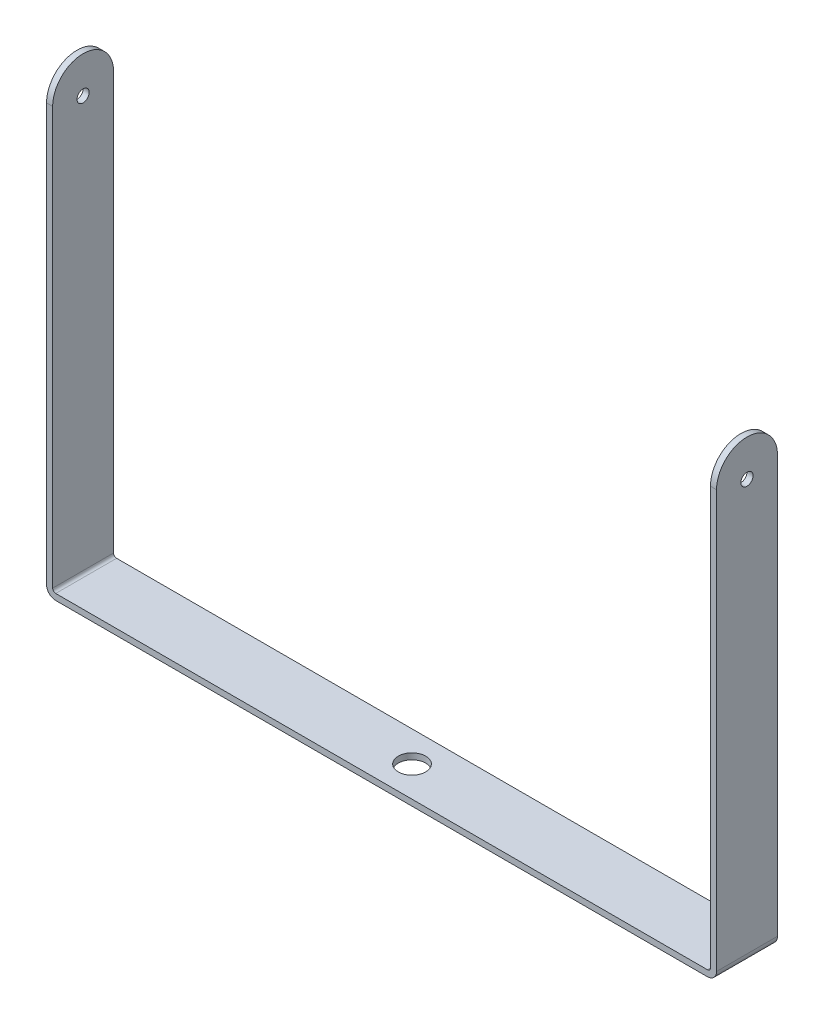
SolidWorks part; units mm, degrees
ref_plane "Plan de face" through (0, 0, 0) normal (0, 0, 1) x (1, 0, 0)
ref_plane "Plan de dessus" through (0, 0, 0) normal (0, 1, 0) x (1, 0, 0)
ref_plane "Plan de droite" through (0, 0, 0) normal (1, 0, 0) x (0, 0, -1)
sketch "Esquisse1" plane through (0, 0, 0) normal (0, 0, 1) x (1, 0, 0)
  line L0 (-110, 2) -> (-110, -135)
  line L1 (-107, -138) -> (107, -138)
  line L2 (110, -135) -> (110, 2)
  line L3 (-108, 2) -> (-108, -135)
  line L4 (-107, -136) -> (107, -136)
  line L5 (108, -135) -> (108, 2)
  line L6 (110, 2) -> (108, 2)
  line L7 (-110, 2) -> (-108, 2)
  line L8 (-108, 2) -> (-108, -136) construction
  line L9 (-108, -136) -> (108, -136) construction
  line L10 (-110, 2) -> (-110, -138) construction
  line L11 (-110, -138) -> (110, -138) construction
  line L12 (110, -138) -> (110, 2) construction
  line L13 (108, -136) -> (108, 2) construction
  arc A0 (-108, -135) -> (-107, -136) centre (-107, -135) ccw
  arc A1 (-110, -135) -> (-107, -138) centre (-107, -135) ccw
  arc A2 (107, -138) -> (110, -135) centre (107, -135) ccw
  arc A3 (107, -136) -> (108, -135) centre (107, -135) ccw
  point P15 (-110, -138)
  dimension "D6" = 1
  dimension "D7" = 3
  dimension "D1" = 1
  dimension "D2" = 220
  dimension "D3" = 110
  dimension "D4" = 138
  dimension "D8" = 140
  dimension "D5" = 2
extrude "Extrusion1" add sketch "Esquisse1" along normal mid plane 20
sketch "Esquisse2" plane through (0, -136, 0) normal (0, 1, 0) x (-1, 0, 0)
  circle A0 centre (0, 0) radius 4.5
  dimension "D1" = 9
extrude "Enlèv. mat.-Extru.1" cut sketch "Esquisse2" against normal through all
sketch "Esquisse3" plane through (110, 0, 0) normal (1, 0, 0) x (0, 0, -1)
  line L0 (-10, 2) -> (10, 2) construction
  line L2 (-10, 2) -> (10, 2)
  arc A0 (10, 2) -> (-10, 2) centre (0, 2) ccw
  dimension "D1" = 10
extrude "Extrusion2" add sketch "Esquisse3" against normal blind 2
mirror "Symétrie1" about plane through (0, 0, 0) normal (1, 0, 0) of "Extrusion2"
sketch "Esquisse4" plane through (-110, 0, 0) normal (-1, 0, 0) x (0, 0, 1)
  circle A0 centre (0, 0) radius 2
  dimension "D1" = 4
extrude "Enlèv. mat.-Extru.2" cut sketch "Esquisse4" against normal through all
